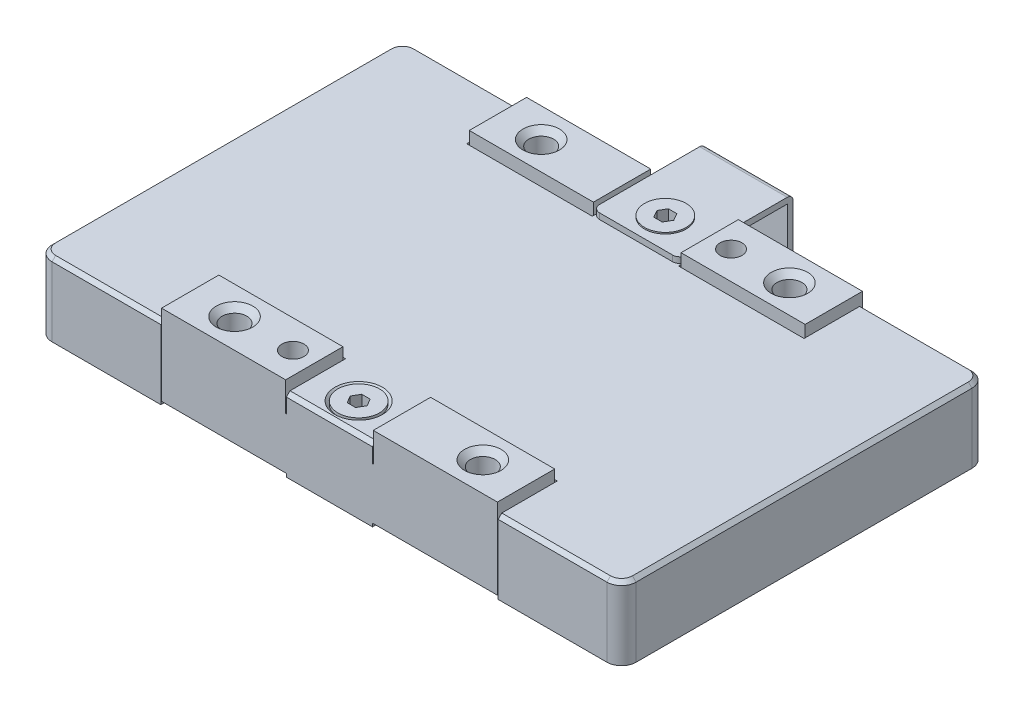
SolidWorks part; units mm, degrees
ref_plane "前视基准面" through (0, 0, 0) normal (0, 0, 1) x (1, 0, 0)
ref_plane "上视基准面" through (0, 0, 0) normal (0, 1, 0) x (1, 0, 0)
ref_plane "右视基准面" through (0, 0, 0) normal (1, 0, 0) x (0, 0, -1)
imported_body "输入1"
other "移动面1" parameters "D1"=0.4
